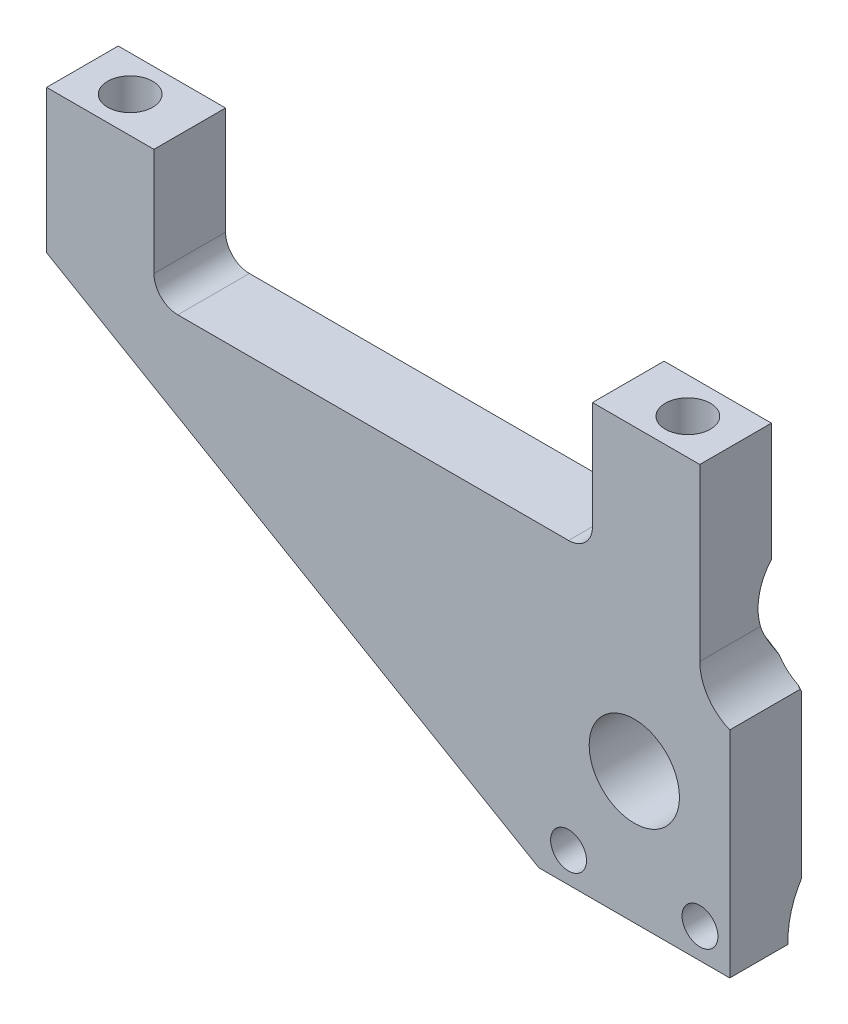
SolidWorks part; units mm, degrees
ref_plane "Front Plane" through (0, 0, 0) normal (0, 0, 1) x (1, 0, 0)
ref_plane "Top Plane" through (0, 0, 0) normal (0, 1, 0) x (1, 0, 0)
ref_plane "Right Plane" through (0, 0, 0) normal (1, 0, 0) x (0, 0, -1)
sketch "Sketch1" plane through (0, 0, 0) normal (0, 0, 1) x (1, 0, 0)
  line L1 (86.868, 11.0998) -> (86.868, 39.6748)
  line L2 (86.868, 39.6748) -> (72.5932, 39.6748)
  line L3 (0, 39.6748) -> (0, 20.6248)
  line L4 (6.35, 39.6748) -> (6.35, 22.1996) construction
  line L5 (80.518, 39.6748) -> (80.518, 22.1996) construction
  line L6 (14.2748, 39.6748) -> (14.2748, 22.1996)
  line L7 (14.2748, 22.1996) -> (72.5932, 22.1996)
  line L8 (72.5932, 22.1996) -> (72.5932, 39.6748)
  line L9 (14.2748, 39.6748) -> (0, 39.6748)
  line L10 (0, 20.6248) -> (65.4558, -17.4752)
  line L11 (65.4558, -17.4752) -> (90.8558, -17.4752)
  line L12 (90.8558, -17.4752) -> (90.8558, 11.0998)
  line L13 (90.8558, 11.0998) -> (86.868, 11.0998)
  line L14 (78.1558, 0) -> (78.1558, -16.8774) construction
  circle A0 centre (78.1558, 0) radius 6
  circle A1 centre (69.4182, -13.4874) radius 2.3876
  circle A2 centre (86.8934, -13.4874) radius 2.3876
  dimension "D7" = 12
  dimension "D11" = 4.7752
  dimension "D2" = 57.15
  dimension "D3" = 6.35
  dimension "D4" = 74.168
  dimension "D5" = 39.6748
  dimension "D6" = 2.3622
  dimension "D8" = 17.4752
  dimension "D9" = 7.9248
  dimension "D10" = 7.9248
  dimension "D12" = 17.4752
  dimension "D13" = 13.4874
  dimension "D14" = 19.05
  dimension "D15" = 6.35
  dimension "D16" = 12.7
  dimension "D17" = 25.4
  dimension "D18" = 28.575
  dimension "D19" = 78.1558
extrude "Boss-Extrude1" add sketch "Sketch1" along normal mid plane 9.525
hole_wizard "M6x1.0 Tapped Hole1" positions "Sketch4" profile "Sketch3" tap size "M6x1.0" standard "ANSI Metric"
sketch "Sketch4" plane through (0, 39.6748, 0) normal (0, 1, 0) x (1, 0, 0)
  point P0 (6.35, 0)
  point P3 (80.518, 0)
sketch "Sketch3" plane through (6.35, 39.6748, 0) normal (1, 0, 0) x (0, 0, 1)
  line L0 (0, 0) -> (0, 16.4882)
  line L1 (0, 16.4882) -> (2.5, 14.986)
  line L2 (2.5, 14.986) -> (2.5, 11.9888)
  line L3 (2.5, 11.9888) -> (3, 11.9888)
  line L4 (3, 11.9888) -> (3, 0)
  line L5 (3, 0) -> (0, 0)
  line L10 (0, 16.4882) -> (-2.5, 14.986) construction
  line L11 (0, -6.35) -> (0, 107.95) construction
  dimension "Tap Drill Dia." = 5
  dimension "Tap Drill Depth" = 14.986
  dimension "Thread Major Dia." = 6
  dimension "Thread Depth" = 11.9888
  dimension "Drill Angle" = 118
fillet "Fillet1" radius 6.35 1 edges at (86.868, 11.0998, 0)
sketch "Sketch5" plane through (0, 0, 0) normal (0, 0, 1) x (1, 0, 0)
  line L0 (78.1558, 0) -> (78.1558, 50.2688) construction
  circle A0 centre (44.45, 38.1) radius 12.7
  dimension "D2" = 25.4
  dimension "D1" = 38.1
  dimension "D3" = 44.45
  dimension "D4" = 33.7058
extrude "Boss-Extrude2" [suppressed] add sketch "Sketch5" along normal blind 33.3248 separate body
fillet "Fillet2" [suppressed] radius 3.175
fillet "Fillet3" radius 3.175 2 edges at (72.5932, 22.1996, 0) (14.2748, 22.1996, 0)
sketch "Sketch7" plane through (0, 0, 0) normal (0, 0, 1) x (1, 0, 0)
  circle A0 centre (69.4182, -13.4874) radius 3.9497
  circle A1 centre (86.8934, -13.4874) radius 3.9497
  dimension "D1" = 7.8994
extrude "Cut-Extrude2" cut sketch "Sketch7" against normal blind 9.8552
sketch "Sketch9" plane through (0, 0, 0) normal (0, 1, 0) x (1, 0, 0)
  line L0 (78.1558, -4.7625) -> (78.1558, 4.7625) construction
  line L1 (65.4558, 4.7625) -> (90.8558, 4.7625) construction
  circle A0 centre (99.2378, 9.3345) radius 6.35
  dimension "D1" = 12.7
  dimension "D2" = 21.082
  dimension "D3" = 4.572
revolve "Cut-Revolve1" cut sketch "Sketch9" angle 360 about axis through (78.1558, 0, 4.7625) along (0, 0, -1)
